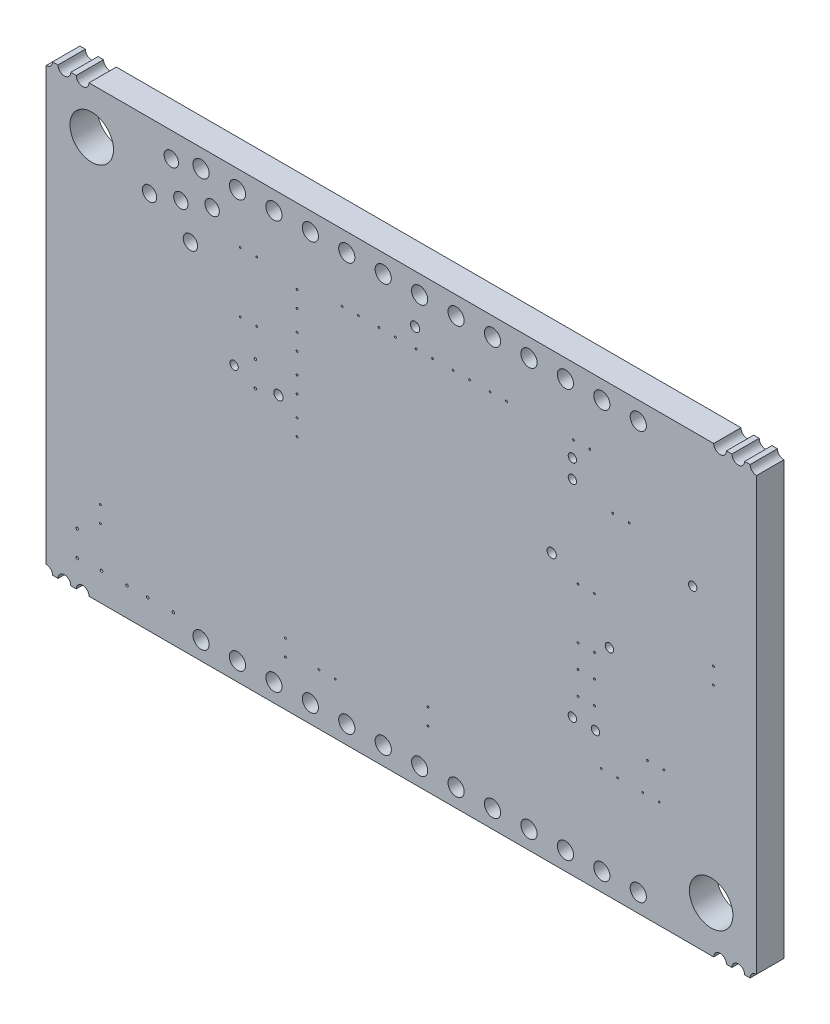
SolidWorks part; units mm, degrees
ref_plane "Front Plane" through (0, 0, 0) normal (0, 0, 1) x (1, 0, 0)
ref_plane "Top Plane" through (0, 0, 0) normal (0, 1, 0) x (1, 0, 0)
ref_plane "Right Plane" through (0, 0, 0) normal (1, 0, 0) x (0, 0, -1)
sketch "Sketch1" plane through (0, 0, 0) normal (0, 0, 1) x (1, 0, 0)
  line L0 (-2.5001, 2.5095) -> (36.4889, 2.5095)
  line L1 (36.4889, 2.5095) -> (36.4889, -21.8999)
  line L2 (36.4889, -21.8999) -> (-2.5001, -21.8999)
  line L3 (-2.5001, -21.8999) -> (-2.5001, 2.5095)
extrude "Board_Outline" add sketch "Sketch1" along normal blind 1.5 separate body
sketch "Sketch2" plane through (0, 0, 0) normal (0, 0, 1) x (1, 0, 0)
  circle A0 centre (25.247, -7.1359) radius 0.254
  circle A1 centre (10.247, -7.1359) radius 0.254
  circle A2 centre (17.747, -0.1359) radius 0.254
extrude "NPTH" cut sketch "Sketch2" along normal through all
sketch "Sketch3" plane through (0, 0, 0) normal (0, 0, 1) x (1, 0, 0)
  circle A0 centre (12, -20.8999) radius 0.4445
  circle A1 centre (14, -20.8999) radius 0.4445
  circle A2 centre (16, -20.8999) radius 0.4445
  circle A3 centre (18, -20.8999) radius 0.4445
  circle A4 centre (20, -20.8999) radius 0.4445
  circle A5 centre (22, -20.8999) radius 0.4445
  circle A6 centre (24, -20.8999) radius 0.4445
  circle A7 centre (26, -20.8999) radius 0.4445
  circle A8 centre (28, -20.8999) radius 0.4445
  circle A9 centre (30, -20.8999) radius 0.4445
  circle A10 centre (10, -20.8999) radius 0.4445
  circle A11 centre (12, 1.5001) radius 0.4445
  circle A12 centre (14, 1.5001) radius 0.4445
  circle A13 centre (16, 1.5001) radius 0.4445
  circle A14 centre (18, 1.5001) radius 0.4445
  circle A15 centre (20, 1.5001) radius 0.4445
  circle A16 centre (22, 1.5001) radius 0.4445
  circle A17 centre (24, 1.5001) radius 0.4445
  circle A18 centre (26, 1.5001) radius 0.4445
  circle A19 centre (28, 1.5001) radius 0.4445
  circle A20 centre (30, 1.5001) radius 0.4445
  circle A21 centre (10, 1.5001) radius 0.4445
  circle A22 centre (33.9999, -19.3998) radius 1.1938
  circle A23 centre (0, 0) radius 1.1938
  circle A24 centre (4.8913, -0.5639) radius 0.3937
  circle A25 centre (6.6089, -0.0388) radius 0.3937
  circle A26 centre (4.3662, 1.1537) radius 0.3937
  circle A27 centre (5.4164, -2.2814) radius 0.3937
  circle A28 centre (3.1737, -1.089) radius 0.3937
  circle A29 centre (27.595, -10.6919) radius 0.05
  circle A30 centre (26.695, -10.6919) radius 0.05
  circle A31 centre (11.27, -1.6059) radius 0.05
  circle A32 centre (11.27, -2.5059) radius 0.05
  circle A33 centre (11.27, -3.6379) radius 0.05
  circle A34 centre (11.27, -4.5379) radius 0.05
  circle A35 centre (28.865, -16.0259) radius 0.05
  circle A36 centre (27.965, -16.0259) radius 0.05
  circle A37 centre (14.641, -1.1669) radius 0.05
  circle A38 centre (13.741, -1.1669) radius 0.05
  circle A39 centre (15.773, -1.1669) radius 0.05
  circle A40 centre (16.673, -1.1669) radius 0.05
  circle A41 centre (17.805, -1.1669) radius 0.05
  circle A42 centre (18.705, -1.1669) radius 0.05
  circle A43 centre (11.27, -5.6699) radius 0.05
  circle A44 centre (11.27, -6.5699) radius 0.05
  circle A45 centre (21.869, -1.1669) radius 0.05
  circle A46 centre (22.769, -1.1669) radius 0.05
  circle A47 centre (19.837, -1.1669) radius 0.05
  circle A48 centre (20.737, -1.1669) radius 0.05
  circle A49 centre (11.27, -7.7019) radius 0.05
  circle A50 centre (11.27, -8.6019) radius 0.05
  circle A51 centre (26.441, -1.1669) radius 0.05
  circle A52 centre (27.341, -1.1669) radius 0.05
  circle A53 centre (0.475, -18.1269) radius 0.05
  circle A54 centre (0.475, -17.2269) radius 0.05
  circle A55 centre (8.153, -4.4689) radius 0.05
  circle A56 centre (9.053, -4.4689) radius 0.05
  circle A57 centre (34.13, -8.9829) radius 0.05
  circle A58 centre (34.13, -8.0829) radius 0.05
  circle A59 centre (27.595, -7.8979) radius 0.05
  circle A60 centre (26.695, -7.8979) radius 0.05
  circle A61 centre (30.505, -14.3749) radius 0.05
  circle A62 centre (31.405, -14.3749) radius 0.05
  circle A63 centre (28.6, -3.5799) radius 0.05
  circle A64 centre (29.5, -3.5799) radius 0.05
  circle A65 centre (31.151, -16.0259) radius 0.05
  circle A66 centre (30.251, -16.0259) radius 0.05
  circle A67 centre (26.695, -13.2319) radius 0.05
  circle A68 centre (27.595, -13.2319) radius 0.05
  circle A69 centre (26.695, -11.9619) radius 0.05
  circle A70 centre (27.595, -11.9619) radius 0.05
  circle A71 centre (10.635, -18.4969) radius 0.05
  circle A72 centre (10.635, -19.3969) radius 0.05
  circle A73 centre (8.153, -1.1669) radius 0.05
  circle A74 centre (9.053, -1.1669) radius 0.05
  circle A75 centre (12.471, -19.0739) radius 0.05
  circle A76 centre (13.371, -19.0739) radius 0.05
  circle A77 centre (18.4582, -17.8619) radius 0.05
  circle A78 centre (18.4582, -18.7619) radius 0.05
  circle A79 centre (8.984, -7.4549) radius 0.07
  circle A80 centre (8.984, -6.0549) radius 0.07
  circle A81 centre (-0.795, -20.4089) radius 0.07
  circle A82 centre (-0.795, -19.0089) radius 0.07
  circle A83 centre (1.937, -20.3439) radius 0.07
  circle A84 centre (0.537, -20.3439) radius 0.07
  circle A85 centre (4.477, -20.3439) radius 0.07
  circle A86 centre (3.077, -20.3439) radius 0.07
  circle A87 centre (7.8156, -6.9327) radius 0.2286
  circle A88 centre (27.653, -14.3749) radius 0.2286
  circle A89 centre (26.383, -3.0719) radius 0.2286
  circle A90 centre (26.383, -14.3749) radius 0.2286
  circle A91 centre (32.987, -4.8499) radius 0.2286
  circle A92 centre (28.415, -10.0569) radius 0.2286
  circle A93 centre (26.383, -2.0559) radius 0.2286
  circle A94 centre (6, -20.8999) radius 0.4445
  circle A95 centre (8, -20.8999) radius 0.4445
  circle A96 centre (6, 1.5001) radius 0.4445
  circle A97 centre (8, 1.5001) radius 0.4445
extrude "PTH" cut sketch "Sketch3" along normal through all
sketch "Place_Keepout " plane through (0, 0, 0) normal (0, 0, 1) x (1, 0, 0)
  line L0 (-2.3223, 2.3825) -> (2.5291, 2.3825)
  line L1 (2.5291, 2.3825) -> (2.5291, 1.2395)
  line L2 (2.5291, 1.2395) -> (-2.3223, 1.2395)
  line L3 (-2.3223, 1.2395) -> (-2.3223, 2.3825)
sketch "Via_Keepout " plane through (0, 0, 0) normal (0, 0, 1) x (1, 0, 0)
  line L0 (-2.3223, 2.3825) -> (2.5291, 2.3825)
  line L1 (2.5291, 2.3825) -> (2.5291, 1.2395)
  line L2 (2.5291, 1.2395) -> (-2.3223, 1.2395)
  line L3 (-2.3223, 1.2395) -> (-2.3223, 2.3825)
sketch "Trace_Keepout " plane through (0, 0, 0) normal (0, 0, 1) x (1, 0, 0)
  line L0 (-2.3223, 2.3825) -> (2.5291, 2.3825)
  line L1 (2.5291, 2.3825) -> (2.5291, 1.2395)
  line L2 (2.5291, 1.2395) -> (-2.3223, 1.2395)
  line L3 (-2.3223, 1.2395) -> (-2.3223, 2.3825)
sketch "Testpoint_Keepout " plane through (0, 0, 0) normal (0, 0, 1) x (1, 0, 0)
  line L0 (-2.3223, 2.3825) -> (2.5291, 2.3825)
  line L1 (2.5291, 2.3825) -> (2.5291, 1.2395)
  line L2 (2.5291, 1.2395) -> (-2.3223, 1.2395)
  line L3 (-2.3223, 1.2395) -> (-2.3223, 2.3825)
sketch "Sketch5" plane through (0, 0, 1.5) normal (0, 0, 1) x (1, 0, 0)
  circle A0 centre (36.4889, 2.5095) radius 0.35
  circle A1 centre (36.4889, -21.8999) radius 0.35
  dimension "D1" = 0.7
extrude "Cut-Extrude1" cut sketch "Sketch5" against normal up to next
pattern_linear "LPattern1" count 3 spacing 1 along (-1, 0, 0) of "Cut-Extrude1"
sketch "Sketch6" plane through (0, 0, 1.5) normal (0, 0, 1) x (1, 0, 0)
  circle A0 centre (-2.5001, 2.5095) radius 0.35
  circle A1 centre (-2.5001, -21.8999) radius 0.35
  dimension "D1" = 0.7
extrude "Cut-Extrude2" cut sketch "Sketch6" against normal up to next
pattern_linear "LPattern2" count 3 spacing 1 along (1, 0, 0) of "Cut-Extrude2"
